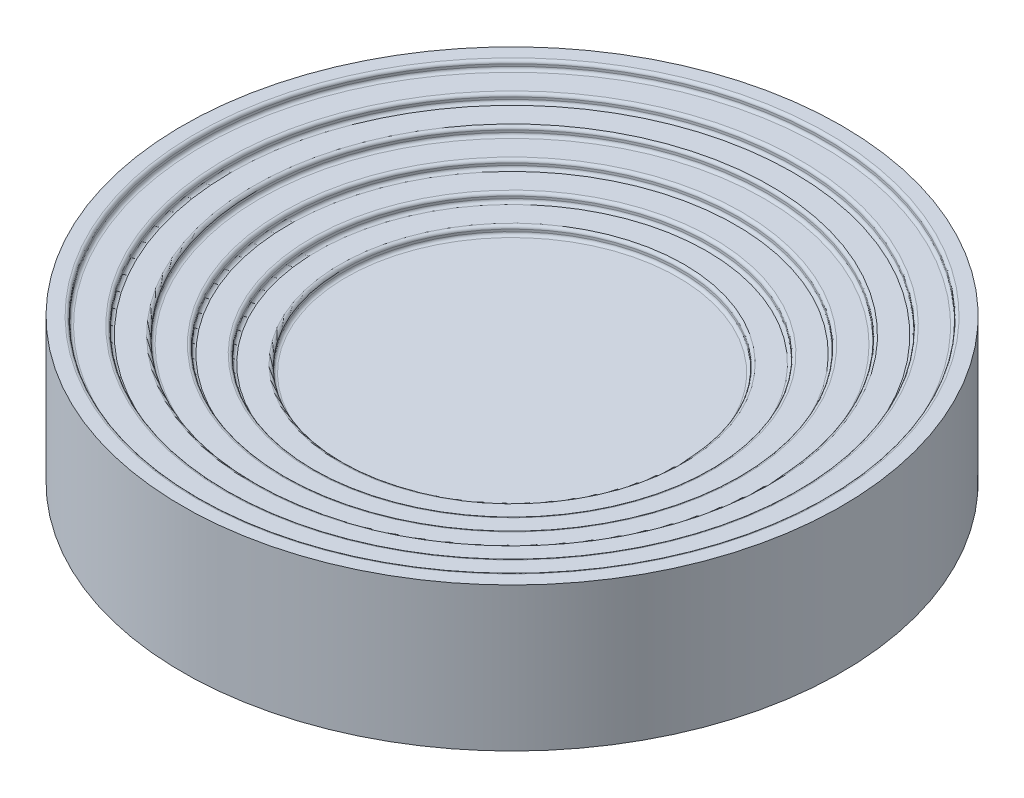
SolidWorks part; units mm, degrees
ref_plane "Płaszczyzna przednia" through (0, 0, 0) normal (0, 0, 1) x (1, 0, 0)
ref_plane "Płaszczyzna górna" through (0, 0, 0) normal (0, 1, 0) x (1, 0, 0)
ref_plane "Płaszczyzna prawa" through (0, 0, 0) normal (1, 0, 0) x (0, 0, -1)
sketch "Szkic2" plane through (0, 0, 0) normal (0, 0, 1) x (1, 0, 0)
  line L0 (0, 0) -> (110, 0)
  line L2 (110, 48) -> (104.5, 48)
  line L4 (0, 31.5) -> (56.375, 31.5)
  line L5 (56.375, 31.5) -> (56.375, 34.25)
  line L6 (56.375, 34.25) -> (66, 34.25)
  line L7 (66, 34.25) -> (66, 37)
  line L8 (66, 37) -> (75.625, 37)
  line L9 (75.625, 37) -> (75.625, 39.75)
  line L10 (75.625, 39.75) -> (85.25, 39.75)
  line L11 (85.25, 39.75) -> (85.25, 42.5)
  line L12 (85.25, 42.5) -> (94.875, 42.5)
  line L13 (94.875, 42.5) -> (94.875, 45.25)
  line L14 (94.875, 45.25) -> (104.5, 45.25)
  line L15 (104.5, 45.25) -> (104.5, 48)
  line L16 (0, 0) -> (110, 0) construction
  line L17 (0, 0) -> (0, 31.5)
  line L18 (110, 0) -> (110, 48)
revolve "Obrót1" add sketch "Szkic2" angle 360 about L17
fillet "Zaokrąglenie1" radius 1 12 edges at (0, 31.5, -56.375) (0, 34.25, -56.375) (0, 34.25, -66) (0, 37, -66) (0, 37, -75.625) (0, 39.75, -75.625) (0, 39.75, -85.25) (0, 42.5, -85.25) (0, 42.5, -94.875) (0, 45.25, -94.875) (0, 45.25, -104.5) (0, 48, -104.5)
sketch "Szkic3" plane through (0, 0, 0) normal (0, -1, 0) x (1, 0, 0)
  circle A0 centre (0, 0) radius 102
  circle A1 centre (0, 0) radius 110 construction
  dimension "D1" = 8
extrude "Wytnij-wyciągnięcie1" cut sketch "Szkic3" against normal blind 27
sketch "Szkic4" plane through (0, 31.5, 0) normal (0, 1, 0) x (1, 0, 0)
  circle A0 centre (0, 0) radius 15
extrude "Wytnij-wyciągnięcie2" [suppressed] cut sketch "Szkic4" against normal blind 27
